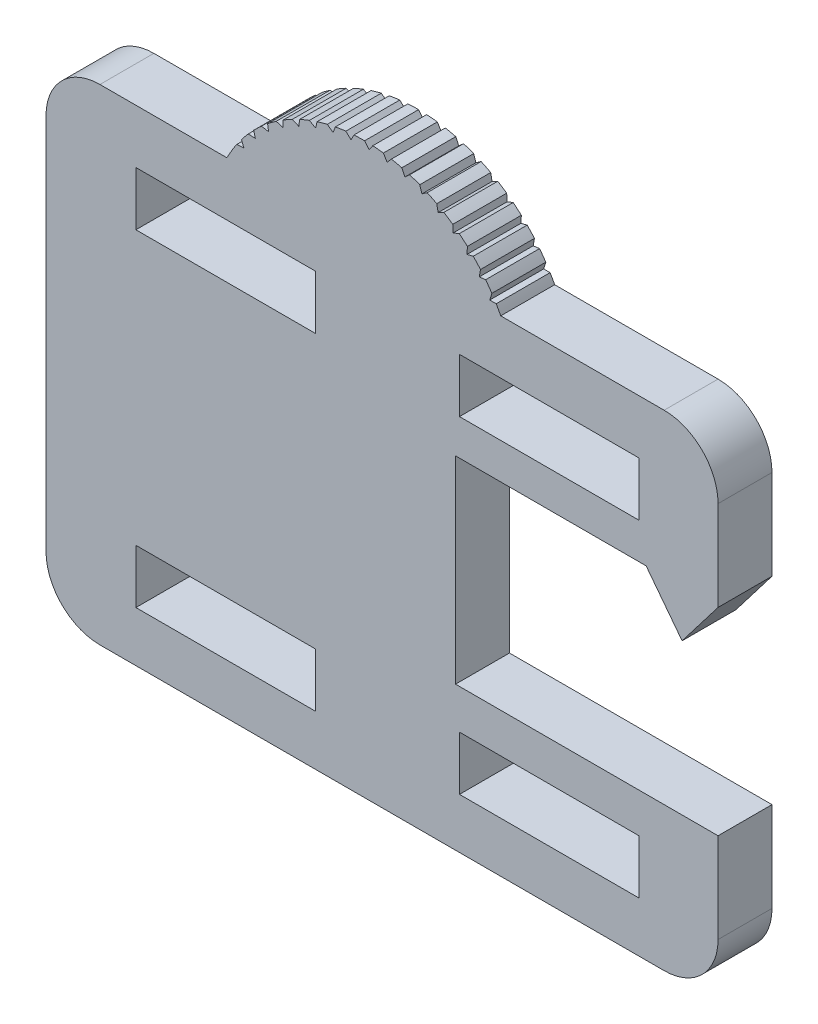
SolidWorks part; units mm, degrees
ref_plane "Plan de face" through (0, 0, 0) normal (0, 0, 1) x (1, 0, 0)
ref_plane "Plan de dessus" through (0, 0, 0) normal (0, 1, 0) x (1, 0, 0)
ref_plane "Plan de droite" through (0, 0, 0) normal (1, 0, 0) x (0, 0, -1)
sketch "Esquisse1" plane through (0, 0, 0) normal (0, 0, 1) x (1, 0, 0)
  line L0 (-8, 0.2) -> (-8, -6.2922) construction
  line L1 (-8, -5.8) -> (-45.3847, -5.8)
  line L2 (-8, -5.8) -> (-8, 2.2)
  line L3 (-8, 21.2) -> (-45.3847, 21.2)
  line L4 (-45.3847, -5.8) -> (-45.3847, 21.2)
  line L5 (-8, 2.2) -> (-22.6034, 2.2)
  line L6 (-8, 13.2) -> (-8, 21.2)
  line L7 (-8, 13.2) -> (-22.6034, 13.2)
  line L8 (-22.6034, 2.2) -> (-22.6034, 13.2)
  line L9 (0, -5.8) -> (-42.3847, -5.8) construction
  line L10 (-12.3847, -3) -> (-12.3847, 0) construction
  line L11 (-12.3847, -3) -> (-22.3847, -3) construction
  line L12 (-12.3847, 0) -> (-22.3847, 0) construction
  line L13 (-22.3847, -3) -> (-22.3847, 0) construction
  line L14 (-12.3847, -3) -> (-12.3847, 0)
  line L15 (-12.3847, -3) -> (-22.3847, -3)
  line L16 (-12.3847, 0) -> (-22.3847, 0)
  line L17 (-22.3847, -3) -> (-22.3847, 0)
  line L18 (-30.3847, -3) -> (-30.3847, 0) construction
  line L19 (-30.3847, 0) -> (-40.3847, 0) construction
  line L20 (-30.3847, -3) -> (-40.3847, -3) construction
  line L21 (-40.3847, -3) -> (-40.3847, 0) construction
  line L22 (-30.3847, -3) -> (-30.3847, 0)
  line L23 (-30.3847, 0) -> (-40.3847, 0)
  line L24 (-30.3847, -3) -> (-40.3847, -3)
  line L25 (-40.3847, -3) -> (-40.3847, 0)
  line L26 (-12.3847, 18.2) -> (-12.3847, 15.2) construction
  line L27 (-22.3847, 15.2) -> (-12.3847, 15.2) construction
  line L28 (-22.3847, 18.2) -> (-12.3847, 18.2) construction
  line L29 (-22.3847, 18.2) -> (-22.3847, 15.2) construction
  line L30 (-12.3847, 18.2) -> (-12.3847, 15.2)
  line L31 (-22.3847, 15.2) -> (-12.3847, 15.2)
  line L32 (-22.3847, 18.2) -> (-12.3847, 18.2)
  line L33 (-22.3847, 18.2) -> (-22.3847, 15.2)
  line L34 (-40.3847, 15.2) -> (-30.3847, 15.2) construction
  line L35 (-30.3847, 18.2) -> (-30.3847, 15.2) construction
  line L36 (-40.3847, 18.2) -> (-30.3847, 18.2) construction
  line L37 (-40.3847, 18.2) -> (-40.3847, 15.2) construction
  line L38 (-40.3847, 15.2) -> (-30.3847, 15.2)
  line L39 (-30.3847, 18.2) -> (-30.3847, 15.2)
  line L40 (-40.3847, 18.2) -> (-30.3847, 18.2)
  line L41 (-40.3847, 18.2) -> (-40.3847, 15.2)
  line L42 (-26.6923, 21.2) -> (-26.6923, -5.8) construction
  line L43 (-45.3847, 7.7) -> (-8, 7.7) construction
  dimension "D2" = 11
extrude "Boss.-Extru.1" add sketch "Esquisse1" along normal blind 3
sketch "Esquisse2" plane through (0, 0, 3) normal (0, 0, 1) x (1, 0, 0)
  line L0 (-8, 13.2) -> (-10, 10.5912)
  line L2 (-10, 10.5912) -> (-12, 13.2)
  line L3 (-22.6034, 13.2) -> (-8, 13.2) construction
  line L4 (-12, 13.2) -> (-8, 13.2)
  line L5 (-10, 13.2) -> (-10, 10.5912) construction
extrude "Boss.-Extru.2" add sketch "Esquisse2" against normal blind 3
fillet "Congé1" radius 3 4 edges at (-8, 21.2, 1.5) (-8, -5.8, 1.5) (-45.3847, 21.2, 1.5) (-45.3847, -5.8, 1.5)
sketch "Esquisse3" plane through (0, 0, 3) normal (0, 0, 1) x (1, 0, 0)
  line L0 (-11, 21.2) -> (-42.3847, 21.2) construction
  line L1 (-20.0903, 21.2) -> (-35.322, 21.2)
  arc A0 (-20.0903, 21.2) -> (-35.322, 21.2) centre (-27.7061, 17.2885) ccw
extrude "Boss.-Extru.3" add sketch "Esquisse3" against normal blind 3
sketch "Esquisse4" plane through (0, 0, 3) normal (0, 0, 1) x (1, 0, 0)
  line L0 (-20.3427, 21.6567) -> (-20.7008, 21.6567)
  line L1 (-20.7008, 21.6567) -> (-20.5831, 22.0385)
  arc A0 (-20.0903, 21.2) -> (-35.322, 21.2) centre (-27.7061, 17.2885) ccw construction
  arc A1 (-20.3427, 21.6567) -> (-20.5831, 22.0385) centre (-27.7061, 17.2885) ccw
extrude "Enlèv. mat.-Extru.1" cut sketch "Esquisse4" against normal blind 3
pattern_circular "Répétition circulaire1" count 17 every 7 about axis through (-27.7061, 17.2885, 0) along (0, 0, 1) of "Enlèv. mat.-Extru.1"
